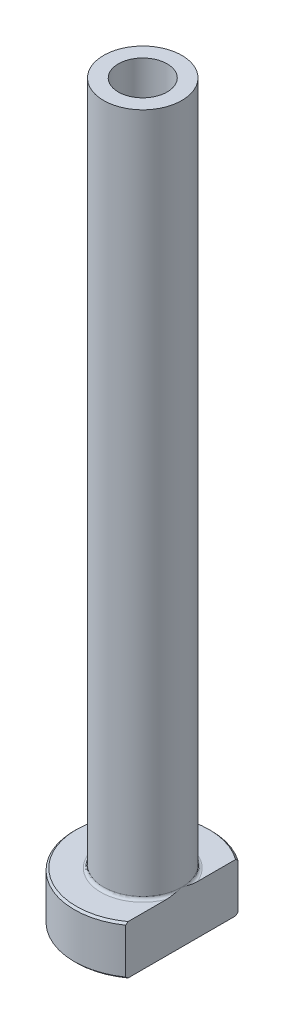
SolidWorks part; units mm, degrees
ref_plane "Front Plane" through (0, 0, 0) normal (0, 0, 1) x (1, 0, 0)
ref_plane "Top Plane" through (0, 0, 0) normal (0, 1, 0) x (1, 0, 0)
ref_plane "Right Plane" through (0, 0, 0) normal (1, 0, 0) x (0, 0, -1)
sketch "Sketch1" plane through (0, 0, 0) normal (0, 0, 1) x (1, 0, 0)
  line L0 (-2.5, 75) -> (-4, 75)
  line L1 (-4, 75) -> (-4, 5)
  line L2 (-4, 5) -> (-7, 5)
  line L3 (-7, 5) -> (-7, 0)
  line L4 (6.05, 0) -> (-6.05, 0) construction
  line L5 (-7, 0) -> (-2.75, 0)
  line L6 (-2.5, 30) -> (-2.5, 75)
  line L7 (0, 92.1877) -> (0, -15.5353) construction
  line L8 (0, -7.7) -> (0, 7.7) construction
  line L9 (-2.5, 30) -> (-2.75, 18)
  line L10 (-2.75, 18) -> (-2.75, 0)
  dimension "D1" = 0.25
  dimension "ID" = 5
  dimension "OD" = 8
  dimension "L" = 75
  dimension "H" = 14
  dimension "T" = 5
  dimension "N" = 45
  dimension "D2" = 12
  dimension "L-N" = 30
revolve "Revolve1" add sketch "Sketch1" angle 360 about L7
fillet "Fillet1" radius 0.3 1 edges at (0, 5, 4)
chamfer "Chamfer1" distance 0.2 angle 45 2 edges at (0, 5, 7) (0, 0, 7)
sketch "Sketch2" plane through (0, 0, 0) normal (0, -1, 0) x (1, 0, 0)
  line L0 (4, 5.7446) -> (4, -5.7446)
  circle A0 centre (0, 0) radius 7 construction
  arc A1 (4, 5.7446) -> (4, -5.7446) centre (0, 0) cw
  circle A2 centre (0, 0) radius 4 construction
extrude "Cut-Extrude1" cut sketch "Sketch2" against normal through all
chamfer "Chamfer2" distance 0.5 angle 45 1 edges at (0, 0, 2.75)
